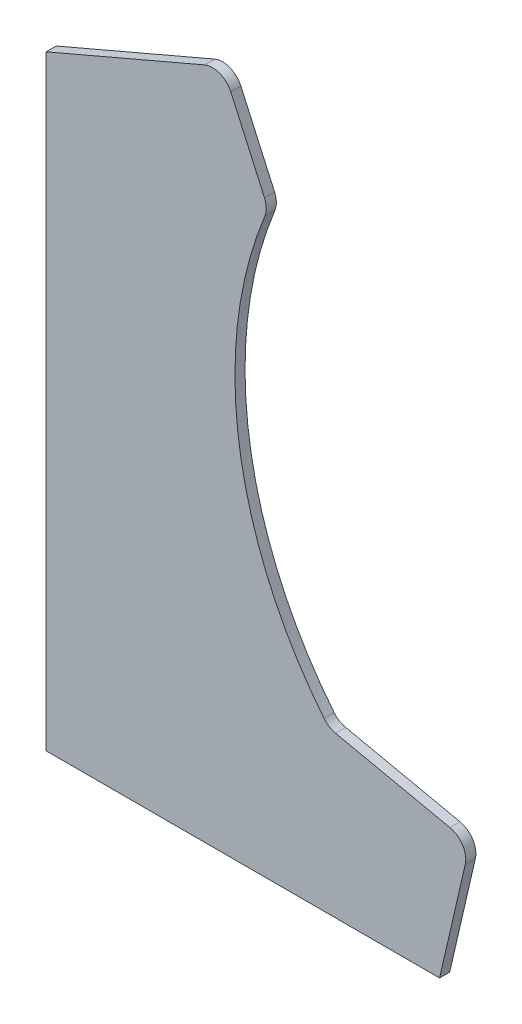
SolidWorks part; units mm, degrees
ref_plane "Alzado" through (0, 0, 0) normal (0, 0, 1) x (1, 0, 0)
ref_plane "Planta" through (0, 0, 0) normal (0, 1, 0) x (1, 0, 0)
ref_plane "Vista lateral" through (0, 0, 0) normal (1, 0, 0) x (0, 0, -1)
sketch "Croquis1" plane through (0, 0, 0) normal (0, 0, 1) x (1, 0, 0)
  line L0 (390, 0) -> (0, 0)
  line L1 (0, 0) -> (0, 600)
  line L3 (0, 600) -> (156.9444, 667.2619)
  line L4 (183.0612, 657.0863) -> (216.4317, 582.9296)
  line L5 (390, 0) -> (415.4316, 110.2037)
  line L6 (400.1344, 134.2569) -> (286.8438, 158.5335)
  arc A1 (216.7148, 567.1757) -> (275.4495, 165.5551) centre (587.1465, 416.2441) ccw
  arc A2 (156.9444, 667.2619) -> (183.0612, 657.0863) centre (164.8228, 648.879) cw
  arc A3 (415.4316, 110.2037) -> (400.1344, 134.2569) centre (395.9438, 114.7009) ccw
  arc A4 (216.4317, 582.9296) -> (216.7148, 567.1757) centre (198.1932, 574.7223) cw
  arc A5 (275.4495, 165.5551) -> (286.8438, 158.5335) centre (291.0343, 178.0895) ccw
  point P8 (0, 0)
  point P9 (357.8295, 360.2254)
  point P12 (175, 675)
  point P16 (420, 130)
  point P19 (220, 575)
  point P22 (280, 160)
  dimension "D6" = 400
  dimension "D12" = 20
  dimension "D13" = 20
  dimension "D14" = 20
  dimension "D15" = 20
  dimension "D1" = 390
  dimension "D2" = 600
  dimension "D3" = 75
  dimension "D4" = 220
  dimension "D5" = 175
  dimension "D7" = 25
  dimension "D8" = 30
  dimension "D9" = 280
  dimension "D10" = 420
  dimension "D11" = 160
extrude "Saliente-Extruir3" add sketch "Croquis1" along normal blind 10 contours L1 L3 A2 L4 A4 A1 A5 L6 A3 L5 L0
